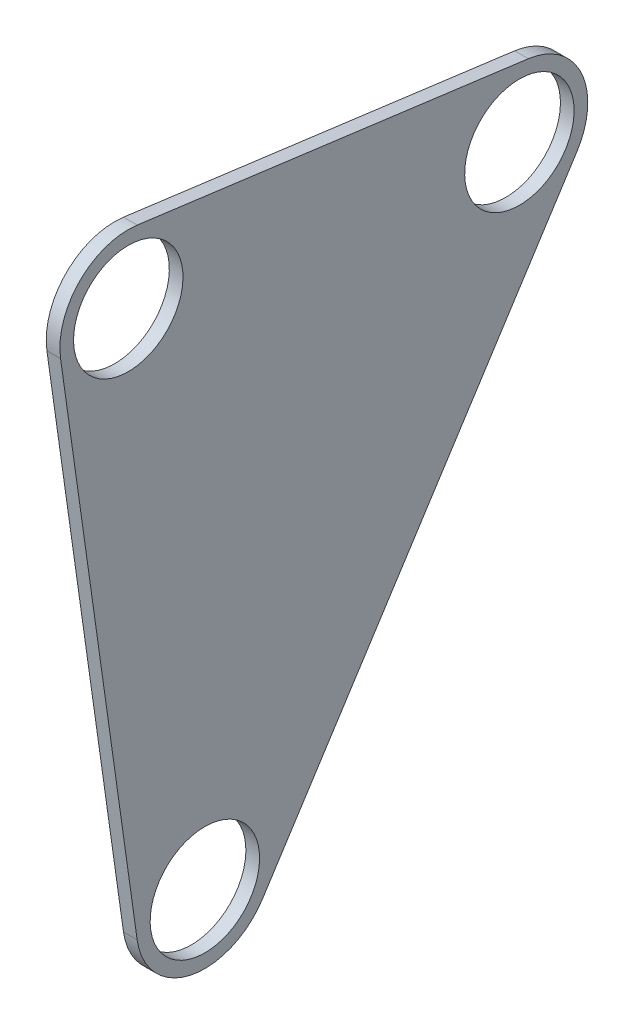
SolidWorks part; units mm, degrees
ref_plane "Plan de face" through (0, 0, 0) normal (0, 0, 1) x (1, 0, 0)
ref_plane "Plan de dessus" through (0, 0, 0) normal (0, 1, 0) x (1, 0, 0)
ref_plane "Plan de droite" through (0, 0, 0) normal (1, 0, 0) x (0, 0, -1)
sketch "Esquisse1" plane through (286.4094, -32.6234, 1411.0725) normal (1, 0, 0) x (0, 0, -1)
  line L0 (-25, 1367.5) -> (-25, 1384.5) construction
  line L1 (-43, 1376) -> (-25, 1376) construction
  line L2 (-43, 1368) -> (-43, 1384) construction
  line L5 (-45, 289) -> (-45, 1414) construction
  line L6 (-45, 1276.9848) -> (-20, 1276.9848) construction
  line L8 (-20, 1276.9848) -> (-34, 1376) construction
  line L14 (-20, 1276.9848) -> (37.5, 1366.5868) construction
  line L15 (37.5, 1366.5868) -> (-34, 1376) construction
  line L16 (25, -16.5) -> (25, 1516.5) construction
  circle A11 centre (37.5, 1366.5868) radius 12.5 construction
  point P24 (-34, 1376)
  point P33 (-34, 1376)
  dimension "D1" = 7.5
  dimension "D8" = 25
  dimension "D3" = 100
  dimension "D2" = 25
ref_plane "Plan3" through (286.4094, 0, 0) normal (1, 0, 0) x (0, 0, -1)
ref_plane "Plan1" through (523.9094, 0, 0) normal (1, 0, 0) x (0, 0, -1)
ref_plane "Plan2" through (523.4094, 0, 0) normal (1, 0, 0) x (0, 0, -1)
sketch "Esquisse2" plane through (523.4094, 0, 0) normal (1, 0, 0) x (0, 0, -1)
  line L0 (-1431.0725, 1244.3614) -> (-1445.0725, 1343.3766) construction
  line L1 (-1431.0725, 1244.3614) -> (-1445.0725, 1343.3766) construction
  line L2 (-1373.5725, 1333.9634) -> (-1445.0725, 1343.3766) construction
  line L3 (-1373.5725, 1333.9634) -> (-1445.0725, 1343.3766) construction
  line L4 (-1431.0725, 1244.3614) -> (-1373.5725, 1333.9634) construction
  line L5 (-1431.0725, 1244.3614) -> (-1373.5725, 1333.9634) construction
  line L6 (-1443.4494, 1242.6114) -> (-1457.4494, 1341.6266)
  line L7 (-1371.9409, 1346.3565) -> (-1443.4409, 1355.7696)
  line L8 (-1420.5524, 1237.6104) -> (-1363.0524, 1327.2124)
  line L9 (-1438.7359, 1209.2751) -> (-1459.7528, 1357.9171) construction
  line L10 (-1352.4166, 1343.7861) -> (-1459.7528, 1357.9171) construction
  line L11 (-1438.7359, 1209.2751) -> (-1352.4166, 1343.7861) construction
  circle A1 centre (-1445.0725, 1343.3766) radius 10
  circle A2 centre (-1373.5725, 1333.9634) radius 10
  circle A4 centre (-1431.0725, 1244.3614) radius 10
  arc A5 (-1457.4494, 1341.6266) -> (-1443.4409, 1355.7696) centre (-1445.0725, 1343.3766) cw
  arc A6 (-1371.9409, 1346.3565) -> (-1363.0524, 1327.2124) centre (-1373.5725, 1333.9634) cw
  arc A7 (-1420.5524, 1237.6104) -> (-1443.4494, 1242.6114) centre (-1431.0725, 1244.3614) cw
  dimension "D1" = 20
  dimension "D2" = 12.5
  dimension "D3" = 12.5
  dimension "D4" = 20
  dimension "D5" = 20
extrude "Boss.-Extru.2" add sketch "Esquisse2" along normal blind 2.5
